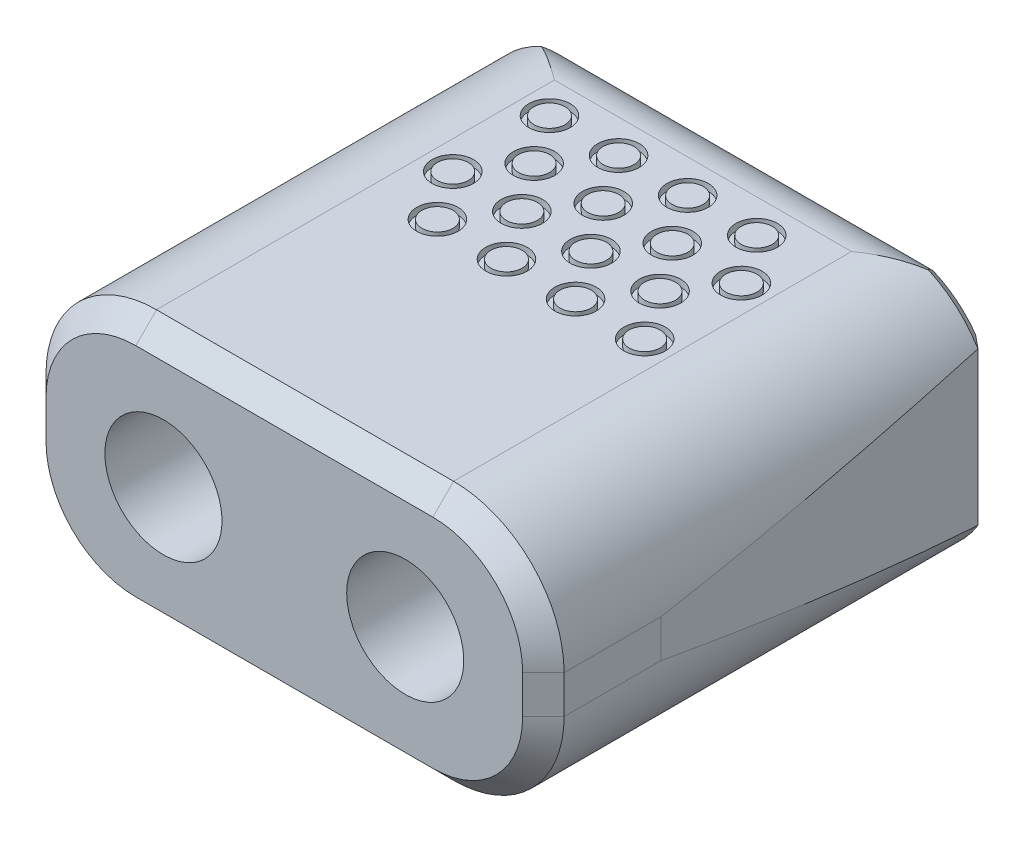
SolidWorks part; units mm, degrees
ref_plane "Front Plane" through (0, 0, 0) normal (0, 0, 1) x (1, 0, 0)
ref_plane "Top Plane" through (0, 0, 0) normal (0, 1, 0) x (1, 0, 0)
ref_plane "Right Plane" through (0, 0, 0) normal (1, 0, 0) x (0, 0, -1)
sketch "Sketch3" plane through (0, 0, 0) normal (1, 0, 0) x (0, 0, -1)
  line L1 (0, -4.7625) -> (16.9672, -4.7625)
  line L2 (0, -4.7625) -> (0, 4.7625)
  line L3 (0, 4.7625) -> (16.9672, 4.7625)
  line L4 (16.9672, -4.7625) -> (16.9672, 4.7625)
  line L6 (0, 0) -> (50000, 0) construction
  dimension "D1" = 16.9672
  dimension "D3" = 9.525
extrude "Extrude1" add sketch "Sketch3" along normal blind 19.05
hole_wizard "#6 CBORE" positions "Sketch7" profile "Sketch6" counterbore size "#6" standard "ANSI Inch"
sketch "Sketch7" plane through (0, 0, -16.9672) normal (0, 0, -1) x (-1, 0, 0)
  line L0 (0, 0) -> (50000, 0) construction
  line L1 (0, 5.2388) -> (0, -5.2388) construction
  point P0 (-5.08, 0)
  point P6 (-13.97, 0)
  dimension "D1" = 5.08
  dimension "D2" = 13.97
sketch "Sketch6" plane through (5.08, 0, -16.9672) normal (1, 0, 0) x (0, 1, 0)
  line L0 (0, 0) -> (0, 16.9672)
  line L1 (0, 16.9672) -> (2.1526, 16.9672)
  line L3 (2.1526, 16.9672) -> (2.1527, 4.064)
  line L4 (2.1527, 4.064) -> (3.302, 4.064)
  line L5 (3.302, 4.064) -> (3.302, 0)
  line L7 (3.302, 0) -> (0, 0)
  line L11 (0, -6.35) -> (0, 107.95) construction
  dimension "Thru Hole Dia." = 4.3053
  dimension "Thru Hole Depth" = 16.9672
  dimension "C'Bore Dia." = 6.604
  dimension "C'Bore Depth" = 4.064
fillet "Fillet1" radius 4.064 4 edges at (19.05, -4.7625, -8.4836) (19.05, 4.7625, -8.4836) (0, 4.7625, -8.4836) (0, -4.7625, -8.4836)
chamfer "Chamfer1" distance 0.3969 angle 45 8 edges at (9.525, -4.7625, -16.9672) (17.8597, -3.5722, -16.9672) (9.525, 4.7625, -16.9672) (19.05, 0, -16.9672) (17.8597, 3.5722, -16.9672) (0, 0, -16.9672) (1.1903, 3.5722, -16.9672) (1.1903, -3.5722, -16.9672)
chamfer "Chamfer2" distance 0.762 angle 45 8 edges at (0, 0, 0) (9.525, -4.7625, 0) (17.8597, -3.5722, 0) (19.05, 0, 0) (17.8597, 3.5722, 0) (9.525, 4.7625, 0) (1.1903, -3.5722, 0) (1.1903, 3.5722, 0)
sketch "Sketch8" plane through (0, 0, 0) normal (-1, 0, 0) x (0, 0, 1)
  line L0 (0, 0) -> (-50000, 0) construction
  line L1 (-15.3924, -4.7625) -> (-15.3924, -7.3025)
  line L2 (-21.7424, -7.3025) -> (-21.7424, -0.9525)
  line L3 (-19.2024, -0.9525) -> (-21.7424, -0.9525)
  line L4 (-15.3924, -7.3025) -> (-21.7424, -7.3025)
  line L5 (-16.9672, -4.7625) -> (-16.9672, 4.7625) construction
  line L6 (0, -4.7625) -> (-16.9672, -4.7625) construction
  line L7 (-16.9672, -4.0774) -> (-17.5721, -4.0774)
  line L8 (-16.9672, 4.0774) -> (-17.5721, 4.0774)
  line L9 (-16.9672, -0.6985) -> (-16.9672, -4.3656) construction
  line L10 (-15.3924, 7.3025) -> (-21.7424, 7.3025)
  line L11 (-19.2024, 0.9525) -> (-21.7424, 0.9525)
  line L12 (-21.7424, 7.3025) -> (-21.7424, 0.9525)
  line L13 (-15.3924, 4.7625) -> (-15.3924, 7.3025)
  line L14 (-0.762, -4.7625) -> (-16.5703, -4.7625) construction
  arc A1 (-19.2024, -0.9525) -> (-17.5721, -4.0774) centre (-15.3924, -0.9525) ccw
  arc A4 (-19.2024, 0.9525) -> (-17.5721, 4.0774) centre (-15.3924, 0.9525) cw
  arc A6 (-16.9672, -4.0774) -> (-15.3924, -4.7625) centre (-15.3924, -2.61) ccw
  arc A7 (-16.9672, 4.0774) -> (-15.3924, 4.7625) centre (-15.3924, 2.61) cw
  dimension "D1" = 3.81
  dimension "D2" = 6.35
  dimension "D4" = 1.5748
extrude "Cut-Extrude2" cut sketch "Sketch8" against normal through all
ref_plane "Plane1" through (9.525, 0, 0) normal (1, 0, 0) x (0, 0, -1)
sketch "Sketch5" plane through (0, 0, 0) normal (0, 1, 0) x (1, 0, 0)
  line L1 (-5.497, 4.318) -> (49994.503, 4.318) construction
  line L3 (-5.2388, 0) -> (5.2388, 0) construction
  line L5 (19.05, 4.318) -> (31.75, 4.318)
  line L6 (31.75, 4.318) -> (31.75, 29.718)
  line L7 (31.75, 29.718) -> (16.4841, 29.718)
  line L8 (19.05, 16.5703) -> (19.05, 0.762) construction
  arc A1 (19.05, 4.318) -> (16.4841, 29.718) centre (-107.95, 4.318) ccw
  dimension "D2" = 127
  dimension "D1" = 4.318
  dimension "D3" = 12.7
  dimension "D4" = 25.4
extrude "Cut-Extrude1" cut sketch "Sketch5" against normal mid plane 25
mirror "Mirror2" about plane through (9.525, 0, 0) normal (1, 0, 0) of "Cut-Extrude1"
chamfer "Chamfer3" distance 0.3969 angle 45 1 edges at (18.4185, 0, -16.9672)
sketch "Sketch10" plane through (0, -4.7625, 0) normal (0, -1, 0) x (1, 0, 0)
  circle A0 centre (5.1079, -14.1663) radius 0.762
  circle A1 centre (5.1079, -14.1663) radius 0.5715
  circle A2 centre (7.6479, -14.1663) radius 0.5715
  circle A3 centre (7.6479, -14.1663) radius 0.762
  circle A4 centre (10.1879, -14.1663) radius 0.5715
  circle A5 centre (10.1879, -14.1663) radius 0.762
  circle A6 centre (12.7279, -14.1663) radius 0.5715
  circle A7 centre (12.7279, -14.1663) radius 0.762
  circle A10 centre (6.3483, -12.3612) radius 0.762
  circle A11 centre (6.3483, -12.3612) radius 0.5715
  circle A12 centre (8.8883, -12.3612) radius 0.762
  circle A13 centre (8.8883, -12.3612) radius 0.5715
  circle A14 centre (11.4283, -12.3612) radius 0.762
  circle A15 centre (11.4283, -12.3612) radius 0.5715
  circle A16 centre (13.9683, -12.3612) radius 0.762
  circle A17 centre (13.9683, -12.3612) radius 0.5715
  circle A18 centre (5.1079, -10.6103) radius 0.762
  circle A19 centre (5.1079, -10.6103) radius 0.5715
  circle A20 centre (7.6479, -10.6103) radius 0.5715
  circle A21 centre (7.6479, -10.6103) radius 0.762
  circle A22 centre (10.1879, -10.6103) radius 0.5715
  circle A23 centre (10.1879, -10.6103) radius 0.762
  circle A24 centre (12.7279, -10.6103) radius 0.5715
  circle A25 centre (12.7279, -10.6103) radius 0.762
  circle A28 centre (6.3483, -8.8052) radius 0.762
  circle A29 centre (6.3483, -8.8052) radius 0.5715
  circle A30 centre (8.8883, -8.8052) radius 0.762
  circle A31 centre (8.8883, -8.8052) radius 0.5715
  circle A32 centre (11.4283, -8.8052) radius 0.762
  circle A33 centre (11.4283, -8.8052) radius 0.5715
  circle A34 centre (13.9683, -8.8052) radius 0.762
  circle A35 centre (13.9683, -8.8052) radius 0.5715
  circle A36 centre (15.2679, -14.1663) radius 0.5715
  circle A37 centre (15.2679, -14.1663) radius 0.762
  dimension "D3" = 5
  dimension "D4" = 2
extrude "Cut-Extrude3" cut sketch "Sketch10" against normal blind 0.254
mirror "Mirror1" about plane through (0, 0, 0) normal (0, 1, 0) of "Cut-Extrude3"
